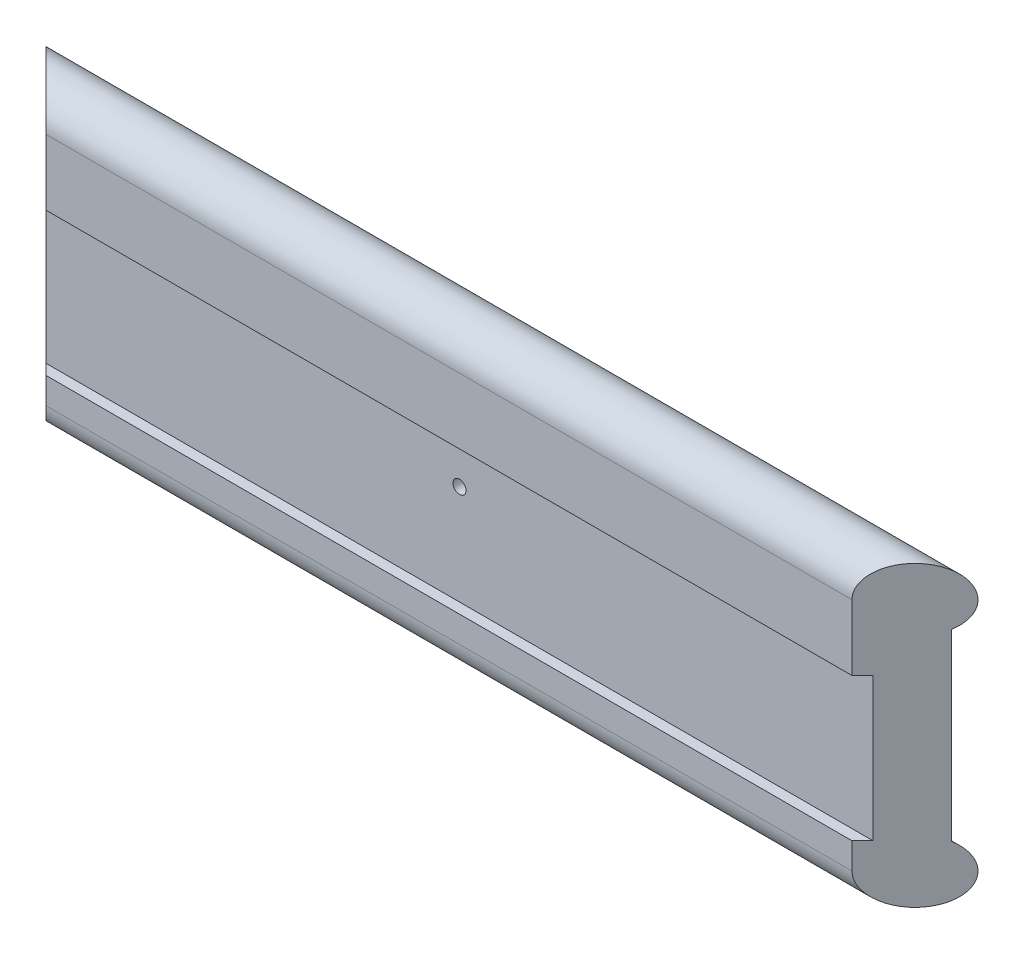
SolidWorks part; units mm, degrees
ref_plane "Front Plane" through (0, 0, 0) normal (0, 0, 1) x (1, 0, 0)
ref_plane "Top Plane" through (0, 0, 0) normal (0, 1, 0) x (1, 0, 0)
ref_plane "Right Plane" through (0, 0, 0) normal (1, 0, 0) x (0, 0, -1)
sketch "Sketch1" plane through (0, 0, 0) normal (0, 0, 1) x (1, 0, 0)
  line L1 (-177.5, -27.25) -> (177.5, -27.25)
  line L2 (-177.5, -27.25) -> (-177.5, 27.25)
  line L3 (-177.5, 27.25) -> (177.5, 27.25)
  line L4 (177.5, -27.25) -> (177.5, 27.25)
  line L5 (-177.5, -27.25) -> (177.5, 27.25) construction
  line L6 (-177.5, 27.25) -> (177.5, -27.25) construction
  point P0 (0, 0)
  dimension "D1" = 355
  dimension "D2" = 54.5
extrude "Boss-Extrude1" add sketch "Sketch1" along normal blind 15
sketch "Sketch2" plane through (-177.5, 0, 0) normal (-1, 0, 0) x (0, 0, 1)
  line L0 (15, 27.25) -> (19, 27.25)
  line L1 (19, 27.25) -> (19, 52.25)
  line L2 (0, 42.5032) -> (0, 27.25)
  line L3 (0, 27.25) -> (15, 27.25)
  line L4 (0, -27.25) -> (15, -27.25)
  line L5 (15, -27.25) -> (19, -27.25)
  line L6 (19, -27.25) -> (19, -37.25)
  line L7 (0, -27.5032) -> (0, -27.25)
  arc A0 (19, 52.25) -> (0, 42.5032) centre (7, 52.25) ccw
  arc A1 (19, -37.25) -> (0, -27.5032) centre (7, -37.25) cw
  dimension "D3" = 12
  dimension "D5" = 12
  dimension "D1" = 4
  dimension "D2" = 25
  dimension "D4" = 10
extrude "Boss-Extrude2" add sketch "Sketch2" against normal up to surface (355 mm away)
sketch "Sketch3" plane through (0, 0, 0) normal (0, 1, 0) x (1, 0, 0)
  line L0 (-177.5, 5) -> (-153.5, -19)
  line L1 (177.5, -19) -> (-177.5, -19) construction
  line L2 (-153.5, -19) -> (0, -19)
  line L3 (0, -19) -> (153.5, -19)
  line L4 (153.5, -19) -> (177.5, 5)
  line L5 (177.5, 5) -> (177.5, -29)
  line L6 (177.5, -29) -> (-177.5, -29)
  line L7 (-177.5, -29) -> (-177.5, 5)
  dimension "D1" = 45
  dimension "D2" = 10
extrude "Cut-Extrude1" cut sketch "Sketch3" against normal through all and the other way through all
sketch "Sketch4" plane through (0, 0, 15) normal (0, 0, 1) x (1, 0, 0)
  line L0 (-157.5, -27.25) -> (157.5, -27.25) construction
  circle A0 centre (0, 10.75) radius 2.5
  dimension "D1" = 5
  dimension "D2" = 38
extrude "Cut-Extrude2" cut sketch "Sketch4" against normal up to surface (15 mm away)
